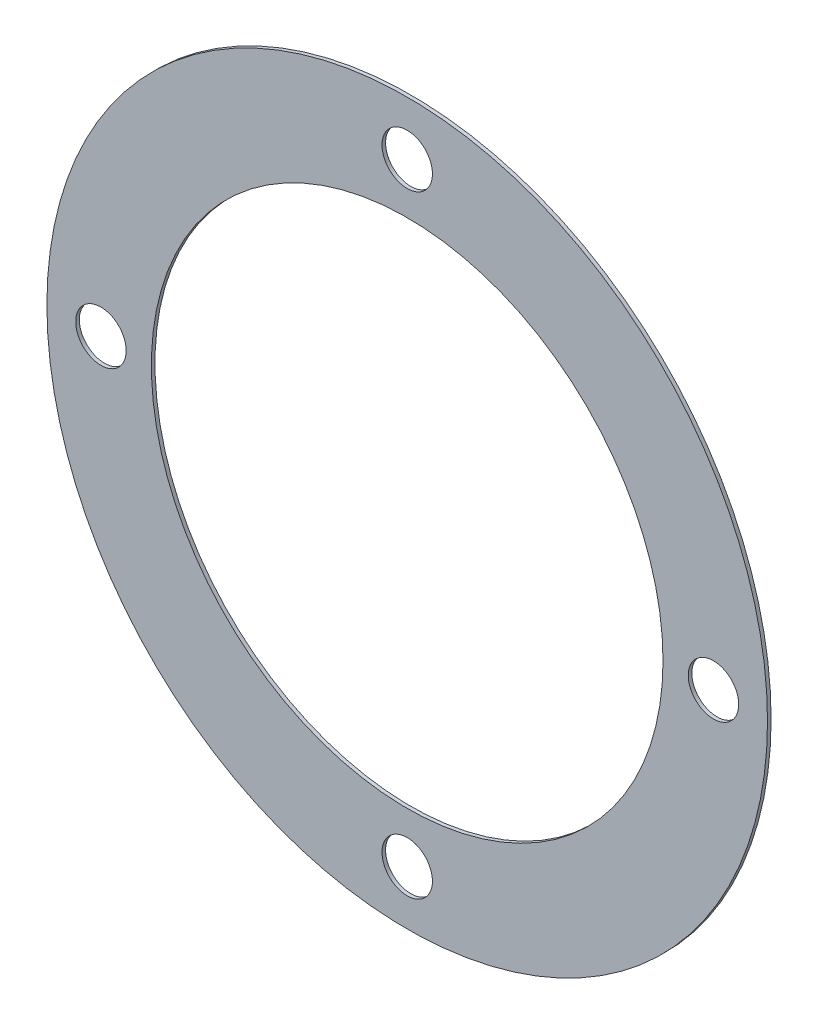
SolidWorks part; units mm, degrees
ref_plane "Plan1" through (0, 0, 0) normal (0, 0, 1) x (1, 0, 0)
ref_plane "Plan2" through (0, 0, 0) normal (0, 1, 0) x (1, 0, 0)
ref_plane "Plan3" through (0, 0, 0) normal (1, 0, 0) x (0, 0, -1)
sketch "Esquisse1" plane through (0, 0, 0) normal (0, 0, 1) x (1, 0, 0)
  circle A6 centre (0, -42.5) radius 3.5
  circle A7 centre (-42.5, 0) radius 3.5
  circle A8 centre (0, 42.5) radius 3.5
  circle A9 centre (42.5, 0) radius 3.5
  arc A11 (-49.9998, -0.1505) -> (49.9998, -0.1505) centre (0, 0) ccw
  arc A13 (49.9998, -0.1505) -> (-49.9998, -0.1505) centre (0, 0) ccw
  circle A14 centre (0, 0) radius 35.5
extrude "Base-Extrusion" add sketch "Esquisse1" along normal blind 0.5
